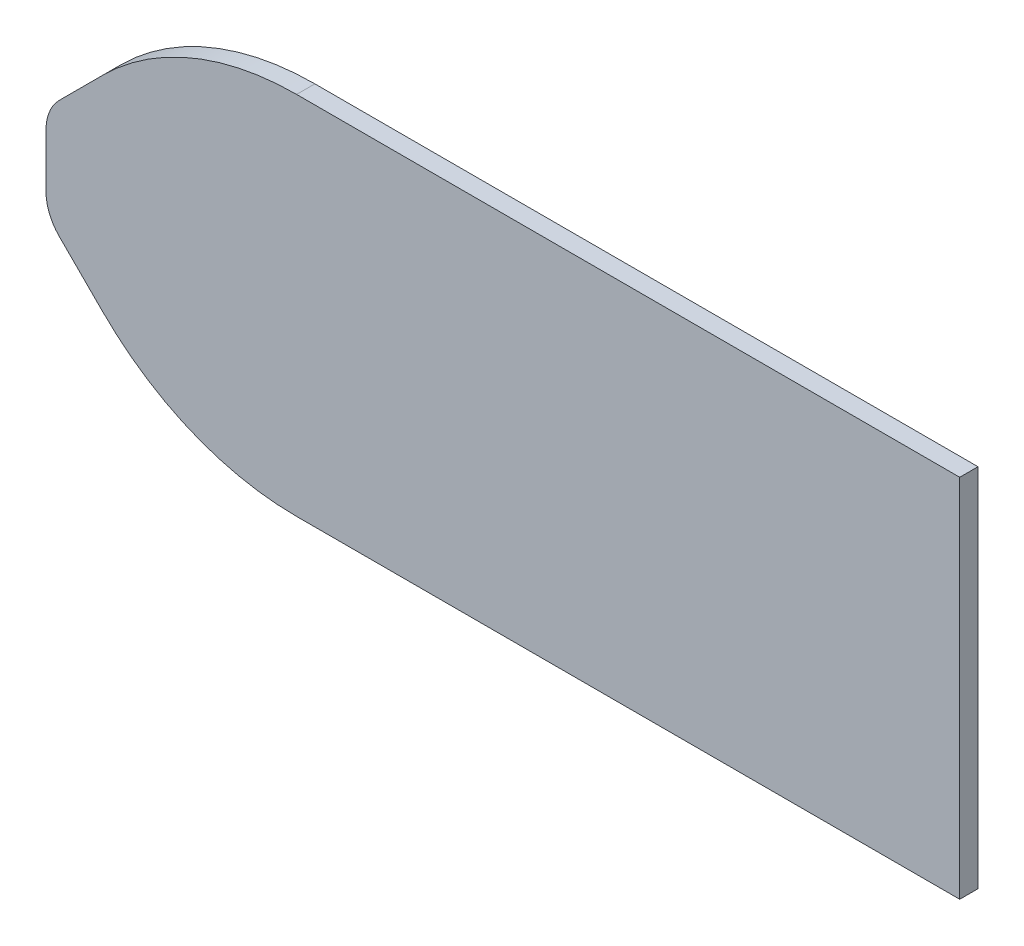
SolidWorks part; units mm, degrees
ref_plane "Front Plane" through (0, 0, 0) normal (0, 0, 1) x (1, 0, 0)
ref_plane "Top Plane" through (0, 0, 0) normal (0, 1, 0) x (1, 0, 0)
ref_plane "Right Plane" through (0, 0, 0) normal (1, 0, 0) x (0, 0, -1)
sketch "Sketch1" plane through (0, 0, 0) normal (0, 0, 1) x (1, 0, 0)
  line L0 (-97.0711, 12.9289) -> (-87.5736, 22.4264)
  line L1 (-45.1472, 40) -> (100, 40)
  line L2 (-100, 5.8579) -> (-100, -5.8579)
  line L3 (-45.1472, -40) -> (100, -40)
  line L4 (100, 40) -> (100, -40)
  line L5 (-100, 40) -> (100, -40) construction
  line L6 (-100, -40) -> (100, 40) construction
  line L7 (-97.0711, -12.9289) -> (-87.5736, -22.4264)
  arc A0 (-87.5736, -22.4264) -> (-45.1472, -40) centre (-45.1472, 20) ccw
  arc A1 (-87.5736, 22.4264) -> (-45.1472, 40) centre (-45.1472, -20) cw
  arc A2 (-97.0711, -12.9289) -> (-100, -5.8579) centre (-90, -5.8579) cw
  arc A3 (-97.0711, 12.9289) -> (-100, 5.8579) centre (-90, 5.8579) ccw
  point P0 (0, 0)
  point P12 (-70, -40)
  point P15 (-70, 40)
  point P18 (-100, -10)
  point P21 (-100, 10)
  dimension "D3" = 60
  dimension "D4" = 10
  dimension "D1" = 80
  dimension "D2" = 200
extrude "Boss-Extrude1" add sketch "Sketch1" along normal blind 4
